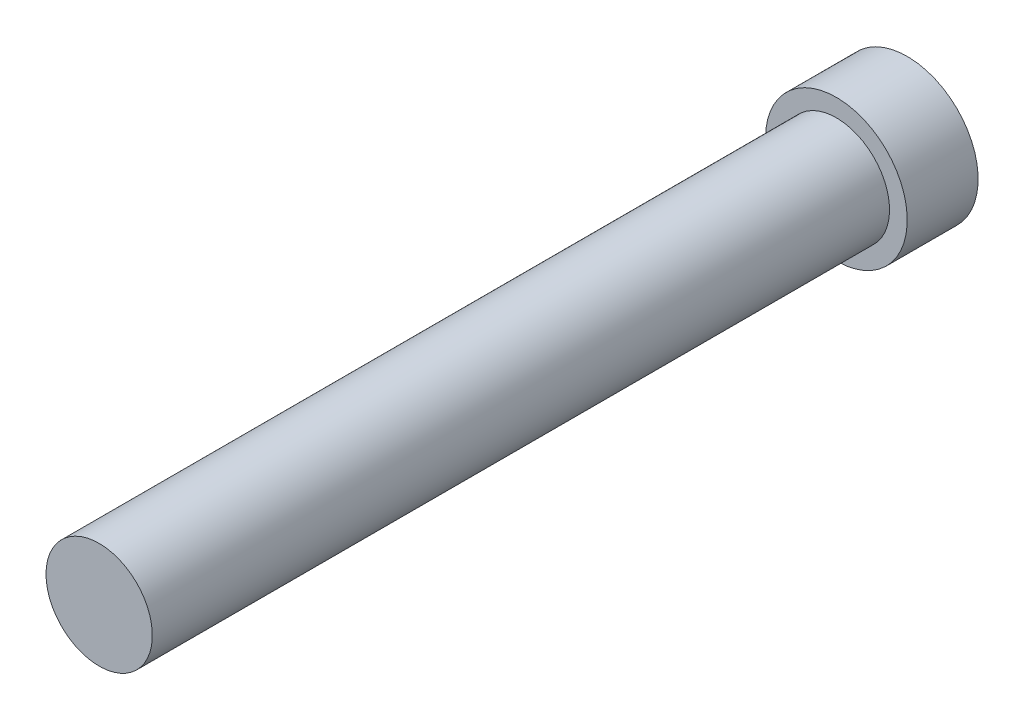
SolidWorks part; units mm, degrees
ref_plane "Front" through (0, 0, 0) normal (0, 0, 1) x (1, 0, 0)
ref_plane "Top" through (0, 0, 0) normal (0, 1, 0) x (1, 0, 0)
ref_plane "Right" through (0, 0, 0) normal (1, 0, 0) x (0, 0, -1)
sketch "Logo3_Revol_Axis" plane through (0, 0, 0) normal (0, 1, 0) x (1, 0, 0)
  line L0 (0, -43.5172) -> (0, 43.5172) construction
sketch "Logo3_bib1" plane through (0, 0, 0) normal (0, -1, 0) x (-1, 0, 0)
  line L0 (2.3813, 0) -> (3.175, 0)
  line L1 (0, 3.175) -> (0, -33.02)
  line L2 (0, -43.5172) -> (0, 43.5172) construction
  line L3 (0, 3.175) -> (3.175, 3.175)
  line L4 (3.175, 0) -> (3.175, 3.175)
  line L7 (0, -33.02) -> (2.3813, -33.02)
  line L8 (2.3813, 0) -> (2.3813, -33.02)
  line L10 (0, 16.5468) -> (0, -90.6614) construction
  dimension "logo3_head_l" = 3.175
  dimension "logo3_l1" = 36.195
  dimension "logo3_d1" = 4.7625
  dimension "logo3_head_d" = 6.35
revolve "Revolve1" add sketch "Logo3_bib1" angle 360 about L10
